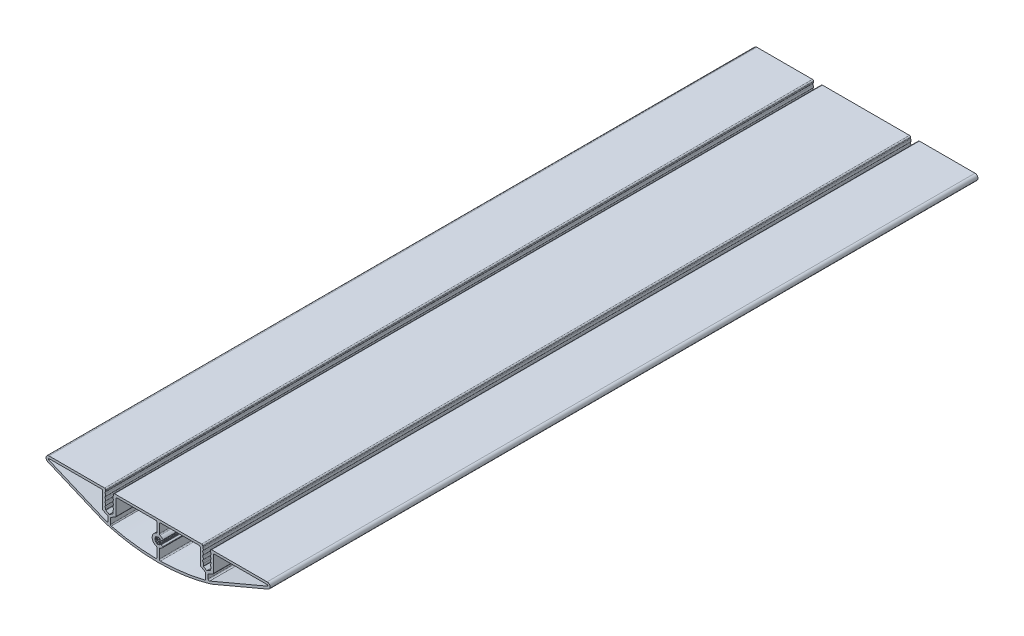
SolidWorks part; units mm, degrees
ref_plane "Спереди" through (0, 0, 0) normal (0, 0, 1) x (1, 0, 0)
ref_plane "Сверху" through (0, 0, 0) normal (0, 1, 0) x (1, 0, 0)
ref_plane "Справа" through (0, 0, 0) normal (1, 0, 0) x (0, 0, -1)
sketch "Model" plane through (0, 0, 0) normal (0, 0, 1) x (1, 0, 0)
  line L0 (648.2273, 2195.971) -> (648.2273, 2199.6425)
  line L1 (647.7273, 2200.1425) -> (631.3344, 2200.1425)
  line L2 (630.8344, 2199.6425) -> (630.8344, 2193.0127)
  line L3 (630.7344, 2192.8395) -> (628.6468, 2191.6342)
  line L4 (628.5468, 2191.461) -> (628.5468, 2189.0629)
  line L5 (648.2273, 2186.6521) -> (648.2273, 2190.3141)
  line L6 (630.2912, 2201.1425) -> (667.1634, 2201.1425)
  line L7 (667.6634, 2200.6425) -> (667.6634, 2200.2829)
  line L8 (667.9079, 2194.3925) -> (667.9079, 2193.3663)
  line L9 (667.9579, 2193.2797) -> (669.4079, 2192.4425)
  line L10 (669.4079, 2192.4425) -> (670.8079, 2193.2508)
  line L11 (670.9079, 2193.424) -> (670.9079, 2193.5425)
  line L12 (670.9079, 2200.3425) -> (670.9079, 2200.6425)
  line L13 (671.4079, 2201.1425) -> (694.9558, 2201.1425)
  line L14 (695.452, 2198.7002) -> (671.9072, 2188.7216)
  line L15 (625.5475, 2188.7216) -> (602.0027, 2198.7002)
  line L16 (602.4989, 2201.1425) -> (626.0468, 2201.1425)
  line L17 (626.5468, 2200.6425) -> (626.5468, 2200.3425)
  line L18 (626.5468, 2193.5425) -> (626.5468, 2193.424)
  line L19 (626.6468, 2193.2508) -> (628.0468, 2192.4425)
  line L20 (628.0468, 2192.4425) -> (629.4968, 2193.2797)
  line L21 (629.5468, 2193.3663) -> (629.5468, 2194.3925)
  line L22 (629.7912, 2200.2829) -> (629.7912, 2200.6425)
  line L23 (650.6937, 2191.9664) -> (650.1223, 2192.3081)
  line L24 (650.1475, 2193.9335) -> (650.7291, 2194.2574)
  line L25 (649.2273, 2195.971) -> (649.2273, 2199.6425)
  line L26 (649.7273, 2200.1425) -> (666.1203, 2200.1425)
  line L27 (666.6203, 2199.6425) -> (666.6203, 2193.0127)
  line L28 (666.7203, 2192.8395) -> (668.8079, 2191.6342)
  line L29 (668.9079, 2191.461) -> (668.9079, 2189.0629)
  line L30 (649.2273, 2186.6521) -> (649.2273, 2190.3141)
  line L31 (694.9558, 2200.1425) -> (672.6955, 2200.1425)
  line L32 (672.1955, 2199.6425) -> (672.1955, 2192.8539)
  line L33 (672.0232, 2192.5825) -> (670.0079, 2191.6342)
  line L34 (669.9079, 2191.461) -> (669.9079, 2189.7153)
  line L35 (670.603, 2189.2549) -> (695.0618, 2199.6209)
  line L36 (627.4468, 2191.6342) -> (625.4315, 2192.5825)
  line L37 (625.2592, 2192.8539) -> (625.2592, 2199.6425)
  line L38 (624.7592, 2200.1425) -> (602.4989, 2200.1425)
  line L39 (602.3929, 2199.6209) -> (626.8517, 2189.2549)
  line L40 (627.5468, 2189.7153) -> (627.5468, 2191.461)
  arc A0 (647.894, 2195.4996) -> (647.894, 2190.7855) centre (648.7273, 2193.1425) ccw
  arc A1 (647.894, 2195.4996) -> (648.2273, 2195.971) centre (647.7273, 2195.971) ccw
  arc A2 (648.2273, 2199.6425) -> (647.7273, 2200.1425) centre (647.7273, 2199.6425) ccw
  arc A3 (631.3344, 2200.1425) -> (630.8344, 2199.6425) centre (631.3344, 2199.6425) ccw
  arc A4 (630.7344, 2192.8395) -> (630.8344, 2193.0127) centre (630.6344, 2193.0127) ccw
  arc A5 (628.6468, 2191.6342) -> (628.5468, 2191.461) centre (628.7468, 2191.461) ccw
  arc A6 (628.5468, 2189.0629) -> (628.896, 2188.5862) centre (629.0468, 2189.0629) ccw
  arc A7 (628.896, 2188.5862) -> (647.7177, 2186.1522) centre (648.967, 2269.8035) ccw
  arc A8 (647.7177, 2186.1522) -> (648.2273, 2186.6521) centre (647.7273, 2186.6521) ccw
  arc A9 (648.2273, 2190.3141) -> (647.894, 2190.7855) centre (647.7273, 2190.3141) ccw
  arc A10 (630.2912, 2201.1425) -> (629.7912, 2200.6425) centre (630.2912, 2200.6425) ccw
  arc A11 (667.6634, 2200.6425) -> (667.1634, 2201.1425) centre (667.1634, 2200.6425) ccw
  arc A12 (667.6634, 2200.2829) -> (667.7682, 2199.9442) centre (668.2634, 2200.2829) ccw
  arc A13 (667.7436, 2199.0068) -> (667.7682, 2199.9442) centre (667.1079, 2199.4925) ccw
  arc A14 (667.7436, 2199.0068) -> (667.7436, 2198.2782) centre (668.2203, 2198.6425) ccw
  arc A15 (667.7436, 2197.3068) -> (667.7436, 2198.2782) centre (667.1079, 2197.7925) ccw
  arc A16 (667.7436, 2197.3068) -> (667.7436, 2196.5782) centre (668.2203, 2196.9425) ccw
  arc A17 (667.7436, 2195.6068) -> (667.7436, 2196.5782) centre (667.1079, 2196.0925) ccw
  arc A18 (667.7436, 2195.6068) -> (667.7436, 2194.8782) centre (668.2203, 2195.2425) ccw
  arc A19 (667.9079, 2194.3925) -> (667.7436, 2194.8782) centre (667.1079, 2194.3925) ccw
  arc A20 (667.9079, 2193.3663) -> (667.9579, 2193.2797) centre (668.0079, 2193.3663) ccw
  arc A21 (670.8079, 2193.2508) -> (670.9079, 2193.424) centre (670.7079, 2193.424) ccw
  arc A22 (671.0722, 2194.0282) -> (670.9079, 2193.5425) centre (671.7079, 2193.5425) ccw
  arc A23 (671.0722, 2194.0282) -> (671.0722, 2194.7568) centre (670.5955, 2194.3925) ccw
  arc A24 (671.0722, 2195.7282) -> (671.0722, 2194.7568) centre (671.7079, 2195.2425) ccw
  arc A25 (671.0722, 2195.7282) -> (671.0722, 2196.4568) centre (670.5955, 2196.0925) ccw
  arc A26 (671.0722, 2197.4282) -> (671.0722, 2196.4568) centre (671.7079, 2196.9425) ccw
  arc A27 (671.0722, 2197.4282) -> (671.0722, 2198.1568) centre (670.5955, 2197.7925) ccw
  arc A28 (671.0722, 2199.1282) -> (671.0722, 2198.1568) centre (671.7079, 2198.6425) ccw
  arc A29 (671.0722, 2199.1282) -> (671.0722, 2199.8568) centre (670.5955, 2199.4925) ccw
  arc A30 (670.9079, 2200.3425) -> (671.0722, 2199.8568) centre (671.7079, 2200.3425) ccw
  arc A31 (671.4079, 2201.1425) -> (670.9079, 2200.6425) centre (671.4079, 2200.6425) ccw
  arc A32 (695.452, 2198.7002) -> (694.9558, 2201.1425) centre (694.9558, 2199.871) ccw
  arc A33 (670.8365, 2188.3381) -> (671.9072, 2188.7216) centre (668.005, 2197.9288) ccw
  arc A34 (626.6181, 2188.3381) -> (670.8365, 2188.3381) centre (648.7273, 2263.2249) ccw
  arc A35 (625.5475, 2188.7216) -> (626.6181, 2188.3381) centre (629.4497, 2197.9288) ccw
  arc A36 (602.4989, 2201.1425) -> (602.0027, 2198.7002) centre (602.4989, 2199.871) ccw
  arc A37 (626.5468, 2200.6425) -> (626.0468, 2201.1425) centre (626.0468, 2200.6425) ccw
  arc A38 (626.3825, 2199.8568) -> (626.5468, 2200.3425) centre (625.7468, 2200.3425) ccw
  arc A39 (626.3825, 2199.8568) -> (626.3825, 2199.1282) centre (626.8592, 2199.4925) ccw
  arc A40 (626.3825, 2198.1568) -> (626.3825, 2199.1282) centre (625.7468, 2198.6425) ccw
  arc A41 (626.3825, 2198.1568) -> (626.3825, 2197.4282) centre (626.8592, 2197.7925) ccw
  arc A42 (626.3825, 2196.4568) -> (626.3825, 2197.4282) centre (625.7468, 2196.9425) ccw
  arc A43 (626.3825, 2196.4568) -> (626.3825, 2195.7282) centre (626.8592, 2196.0925) ccw
  arc A44 (626.3825, 2194.7568) -> (626.3825, 2195.7282) centre (625.7468, 2195.2425) ccw
  arc A45 (626.3825, 2194.7568) -> (626.3825, 2194.0282) centre (626.8592, 2194.3925) ccw
  arc A46 (626.5468, 2193.5425) -> (626.3825, 2194.0282) centre (625.7468, 2193.5425) ccw
  arc A47 (626.5468, 2193.424) -> (626.6468, 2193.2508) centre (626.7468, 2193.424) ccw
  arc A48 (629.4968, 2193.2797) -> (629.5468, 2193.3663) centre (629.4468, 2193.3663) ccw
  arc A49 (629.7111, 2194.8782) -> (629.5468, 2194.3925) centre (630.3468, 2194.3925) ccw
  arc A50 (629.7111, 2194.8782) -> (629.7111, 2195.6068) centre (629.2344, 2195.2425) ccw
  arc A51 (629.7111, 2196.5782) -> (629.7111, 2195.6068) centre (630.3468, 2196.0925) ccw
  arc A52 (629.7111, 2196.5782) -> (629.7111, 2197.3068) centre (629.2344, 2196.9425) ccw
  arc A53 (629.7111, 2198.2782) -> (629.7111, 2197.3068) centre (630.3468, 2197.7925) ccw
  arc A54 (629.7111, 2198.2782) -> (629.7111, 2199.0068) centre (629.2344, 2198.6425) ccw
  arc A55 (629.6865, 2199.9442) -> (629.7111, 2199.0068) centre (630.3468, 2199.4925) ccw
  arc A56 (629.6865, 2199.9442) -> (629.7912, 2200.2829) centre (629.1912, 2200.2829) ccw
  arc A57 (650.7531, 2191.6775) -> (650.6937, 2191.9664) centre (650.591, 2191.7947) ccw
  arc A58 (650.1223, 2192.3081) -> (649.8503, 2192.2428) centre (650.0197, 2192.1365) ccw
  arc A59 (649.6721, 2192.1815) -> (649.8503, 2192.2428) centre (649.7232, 2192.3226) ccw
  arc A60 (649.6721, 2192.1815) -> (649.4183, 2191.9855) centre (649.6075, 2192.0028) ccw
  arc A61 (649.1616, 2191.8667) -> (649.4183, 2191.9855) centre (649.2689, 2191.9717) ccw
  arc A62 (649.1616, 2191.8667) -> (648.8479, 2191.8003) centre (649.0259, 2191.7338) ccw
  arc A63 (648.5651, 2191.8047) -> (648.8479, 2191.8003) centre (648.7072, 2191.8528) ccw
  arc A64 (648.5651, 2191.8047) -> (648.2535, 2191.8809) centre (648.3851, 2191.7438) ccw
  arc A65 (648.0007, 2192.0076) -> (648.2535, 2191.8809) centre (648.1496, 2191.9892) ccw
  arc A66 (648.0007, 2192.0076) -> (647.7531, 2192.2114) centre (647.8121, 2192.0308) ccw
  arc A67 (647.5802, 2192.4353) -> (647.7531, 2192.2114) centre (647.7064, 2192.3541) ccw
  arc A68 (647.5802, 2192.4353) -> (647.4456, 2192.7263) centre (647.4204, 2192.538) ccw
  arc A69 (647.3869, 2193.003) -> (647.4456, 2192.7263) centre (647.4655, 2192.8751) ccw
  arc A70 (647.3869, 2193.003) -> (647.3919, 2193.3237) centre (647.2875, 2193.165) ccw
  arc A71 (647.4592, 2193.5984) -> (647.3919, 2193.3237) centre (647.4744, 2193.4491) ccw
  arc A72 (647.4592, 2193.5984) -> (647.6028, 2193.8852) centre (647.4399, 2193.7875) ccw
  arc A73 (647.7826, 2194.1035) -> (647.6028, 2193.8852) centre (647.7315, 2193.9624) ccw
  arc A74 (647.7826, 2194.1035) -> (648.0364, 2194.2995) centre (647.8472, 2194.2822) ccw
  arc A75 (648.2931, 2194.4183) -> (648.0364, 2194.2995) centre (648.1859, 2194.3133) ccw
  arc A76 (648.2931, 2194.4183) -> (648.6068, 2194.4848) centre (648.4288, 2194.5512) ccw
  arc A77 (648.8896, 2194.4804) -> (648.6068, 2194.4848) centre (648.7475, 2194.4322) ccw
  arc A78 (648.8896, 2194.4804) -> (649.2012, 2194.4041) centre (649.0696, 2194.5412) ccw
  arc A79 (649.454, 2194.2774) -> (649.2012, 2194.4041) centre (649.3051, 2194.2958) ccw
  arc A80 (649.454, 2194.2774) -> (649.7016, 2194.0736) centre (649.6426, 2194.2542) ccw
  arc A81 (649.8777, 2194.007) -> (649.7016, 2194.0736) centre (649.7483, 2193.931) ccw
  arc A82 (649.8777, 2194.007) -> (650.1475, 2193.9335) centre (650.0501, 2194.108) ccw
  arc A83 (650.7291, 2194.2574) -> (650.7974, 2194.5443) centre (650.6318, 2194.4321) ccw
  arc A84 (650.7974, 2194.5443) -> (649.5607, 2195.4996) centre (648.7264, 2193.1413) ccw
  arc A85 (649.2273, 2195.971) -> (649.5607, 2195.4996) centre (649.7273, 2195.971) ccw
  arc A86 (649.7273, 2200.1425) -> (649.2273, 2199.6425) centre (649.7273, 2199.6425) ccw
  arc A87 (666.6203, 2199.6425) -> (666.1203, 2200.1425) centre (666.1203, 2199.6425) ccw
  arc A88 (666.6203, 2193.0127) -> (666.7203, 2192.8395) centre (666.8203, 2193.0127) ccw
  arc A89 (668.9079, 2191.461) -> (668.8079, 2191.6342) centre (668.7079, 2191.461) ccw
  arc A90 (668.5587, 2188.5862) -> (668.9079, 2189.0629) centre (668.4079, 2189.0629) ccw
  arc A91 (649.737, 2186.1522) -> (668.5587, 2188.5862) centre (648.4877, 2269.8035) ccw
  arc A92 (649.2273, 2186.6521) -> (649.737, 2186.1522) centre (649.7273, 2186.6521) ccw
  arc A93 (649.5607, 2190.7855) -> (649.2273, 2190.3141) centre (649.7273, 2190.3141) ccw
  arc A94 (649.5607, 2190.7855) -> (650.7531, 2191.6775) centre (648.7273, 2193.1425) ccw
  arc A95 (695.0618, 2199.6209) -> (694.9558, 2200.1425) centre (694.9558, 2199.871) ccw
  arc A96 (672.6955, 2200.1425) -> (672.1955, 2199.6425) centre (672.6955, 2199.6425) ccw
  arc A97 (672.0232, 2192.5825) -> (672.1955, 2192.8539) centre (671.8955, 2192.8539) ccw
  arc A98 (670.0079, 2191.6342) -> (669.9079, 2191.461) centre (670.1079, 2191.461) ccw
  arc A99 (669.9079, 2189.7153) -> (670.603, 2189.2549) centre (670.4079, 2189.7153) ccw
  arc A100 (627.5468, 2191.461) -> (627.4468, 2191.6342) centre (627.3468, 2191.461) ccw
  arc A101 (625.2592, 2192.8539) -> (625.4315, 2192.5825) centre (625.5592, 2192.8539) ccw
  arc A102 (625.2592, 2199.6425) -> (624.7592, 2200.1425) centre (624.7592, 2199.6425) ccw
  arc A103 (602.4989, 2200.1425) -> (602.3929, 2199.6209) centre (602.4989, 2199.871) ccw
  arc A104 (626.8517, 2189.2549) -> (627.5468, 2189.7153) centre (627.0468, 2189.7153) ccw
  dimension "D1" = 41.3611
extrude "Бобышка-Вытянуть1" add sketch "Model" along normal blind 300
